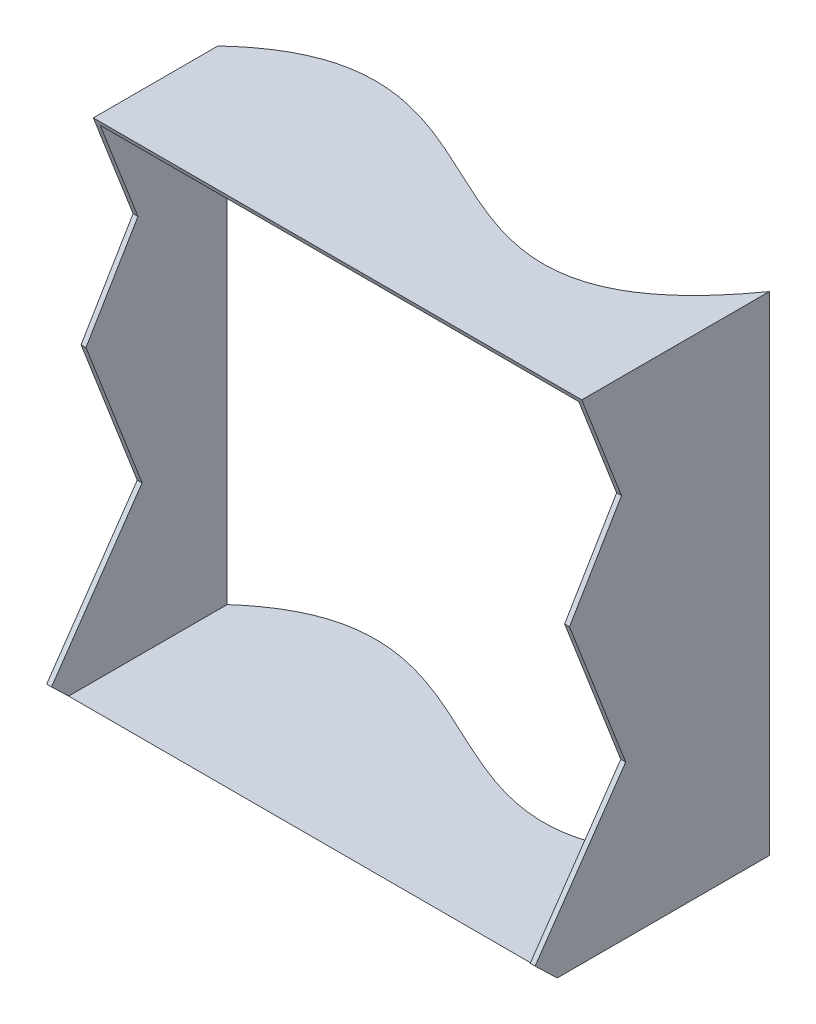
SolidWorks part; units mm, degrees
ref_plane "Ebene vorne" through (0, 0, 0) normal (0, 0, 1) x (1, 0, 0)
ref_plane "Ebene oben" through (0, 0, 0) normal (0, 1, 0) x (1, 0, 0)
ref_plane "Ebene rechts" through (0, 0, 0) normal (1, 0, 0) x (0, 0, -1)
sketch "Skizze1" plane through (0, 0, 0) normal (0, 0, 1) x (1, 0, 0)
  line L1 (-50, -50) -> (50, -50)
  line L2 (-50, -50) -> (-50, 50)
  line L3 (-50, 50) -> (50, 50)
  line L4 (50, -50) -> (50, 50)
  line L5 (-50, -50) -> (50, 50) construction
  line L6 (-50, 50) -> (50, -50) construction
  point P0 (0, 0)
  dimension "D1" = 100
  dimension "D2" = 100
extrude "Aufsatz-Linear austragen1" add sketch "Skizze1" along normal blind 100
shell "Wandung1" thickness 1
other "Formnest1"
other "f1<1>@Formnest 20101"
other "f3<1>@Formnest 20101"
